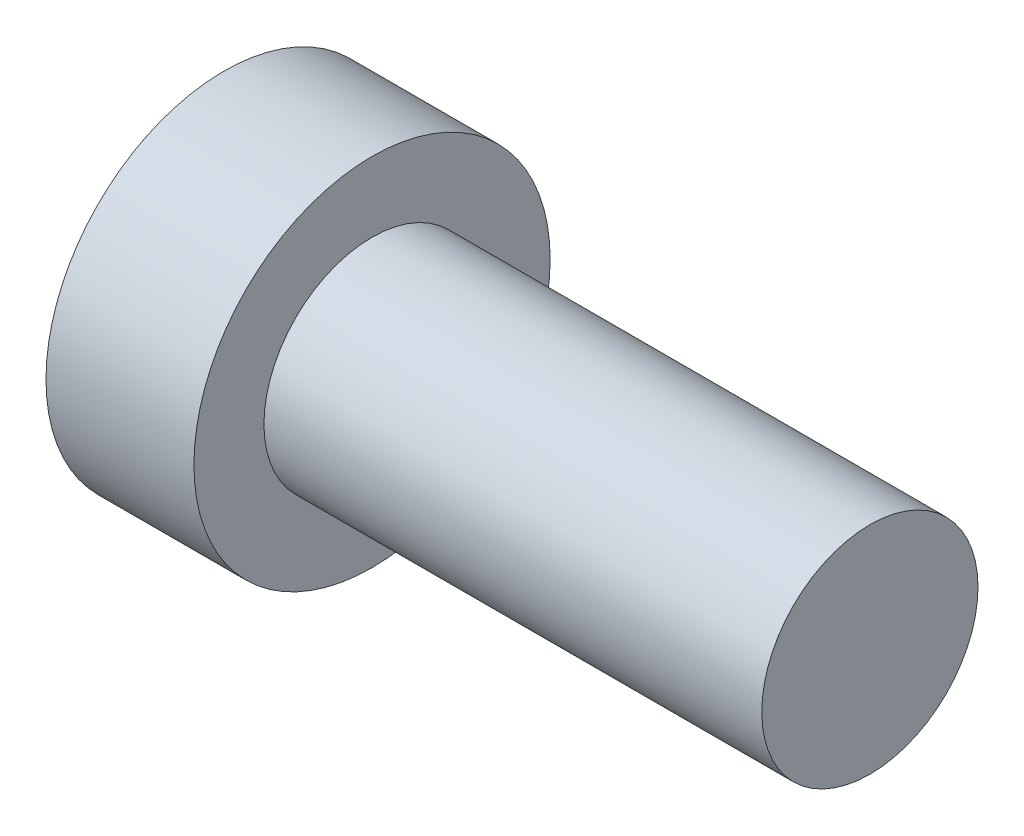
SolidWorks part; units mm, degrees
ref_plane "Plane1" through (0, 0, 0) normal (0, 0, 1) x (1, 0, 0)
ref_plane "Plane2" through (0, 0, 0) normal (0, 1, 0) x (1, 0, 0)
ref_plane "Plane3" through (0, 0, 0) normal (1, 0, 0) x (0, 0, -1)
revolve "Base-Revolve" add sketch "BodySke" angle 360 about L2
sketch "BodySke" plane through (0, 0, 0) normal (0, 0, 1) x (1, 0, 0)
  line L0 (4.572, 2.413) -> (4.572, 3.9751)
  line L1 (4.572, 3.9751) -> (1.27, 3.9751)
  line L2 (-25.4, 0) -> (127, 0) construction
  line L3 (15.6845, 0) -> (0, 0)
  line L4 (4.572, 2.413) -> (15.6845, 2.413)
  line L5 (15.6845, 2.413) -> (15.6845, 0)
  line L6 (4.572, -3.9751) -> (1.27, -3.9751) construction
  line L7 (4.572, -2.413) -> (15.6845, -2.413) construction
  line L8 (5.6312, 1.2192) -> (5.6312, -0.4698) construction
  line L9 (4.572, 1.2192) -> (4.572, -0.4698) construction
  arc A0 (0, 0) -> (1.27, 3.9751) centre (6.856, 0) cw
  dimension "Head_ht" = 4.572
  dimension "Diameter" = 4.826
  dimension "Length" = 11.1125
  dimension "Head_dia" = 7.9502
  dimension "Head_side_ht" = 3.302
  dimension "Advance" = 1.0592
  dimension "Thread_nom" = 11.1125
sketch "Sketch2" plane through (0, 0, 0) normal (1, 0, 0) x (0, 0, -1)
  line L0 (-3.9751, -0.762) -> (-3.9751, 0.762)
  line L1 (-3.9751, 0.762) -> (3.9751, 0.762)
  line L2 (3.9751, 0.762) -> (3.9751, -0.762)
  line L3 (3.9751, -0.762) -> (-3.9751, -0.762)
  dimension "D1" = 7.9502
  dimension "D2" = 3.9751
  dimension "D3" = 0.762
  dimension "Slot_width" = 1.524
extrude "Slot" cut sketch "Sketch2" along normal blind 2.1082
sketch "Sketch3" plane through (0, 0, 0) normal (1, 0, 0) x (0, 0, -1)
  line L0 (0.5461, -2.9845) -> (-0.5461, -2.9845)
  line L1 (0.5461, -2.9845) -> (0.5461, 2.9845)
  line L2 (-0.5461, 2.9845) -> (0.5461, 2.9845)
  line L3 (-0.5461, 2.9845) -> (-0.5461, -2.9845)
  dimension "D1" = 0.5461
  dimension "Cross_width" = 1.0922
  dimension "D2" = 2.9845
  dimension "Cross_dia" = 5.969
ref_plane "Plane4" through (3.4036, 0, 0) normal (1, 0, 0) x (0, 0, -1)
sketch "Sketch4" plane through (3.4036, 0, 0) normal (1, 0, 0) x (0, 0, -1)
  line L0 (0.2731, -0.2731) -> (-0.273, -0.2731)
  line L1 (0.2731, -0.2731) -> (0.2731, 0.2731)
  line L2 (-0.2731, 0.2731) -> (0.2731, 0.2731)
  line L3 (-0.2731, 0.2731) -> (-0.273, -0.2731)
  dimension "D1" = 0.5461
  dimension "D2" = 0.2731
  dimension "D3" = 0.5461
  dimension "D4" = 0.2731
loft "Cross" cut profiles "Sketch3", "Sketch4"
pattern_circular "CirPattern1" count 2 every 90 about axis through (0, 0, 0) along (1, 0, 0) of "Cross"
sketch "Sketch5" plane through (0, 0, 0) normal (0, 1, 0) x (1, 0, 0)
  line L4 (-25.4, 0) -> (127, 0) construction
  line L5 (4.572, -6.312) -> (4.572, 6.3337) construction
  circle A0 centre (3.4798, 0) radius 0.5842
  dimension "Drilled_hole_dia" = 1.1684
  dimension "D1" = 4.572
  dimension "Drilled_hole_loc" = 1.0922
extrude "Hole" cut sketch "Sketch5" against normal through all and the other way through all
sketch "ThdSchSke" plane through (0, 0, 0) normal (0, 0, 1) x (1, 0, 0)
  line L0 (5.6312, -1.7831) -> (5.1901, -2.413)
  line L1 (5.6312, -1.7831) -> (6.0723, -2.413)
  line L2 (6.0723, -2.413) -> (6.0723, -3.0162)
  line L3 (-3.175, 0) -> (5.1513, 0) construction
  line L5 (6.0723, -3.0162) -> (5.1901, -3.0162)
  line L6 (5.1901, -3.0162) -> (5.1901, -2.413)
  dimension "Thread_minor" = 3.5662
  dimension "Diameter" = 4.826
  dimension "Start" = 5.6312
  dimension "SideAngle" = 55
  dimension "VeeAngle" = 70
  dimension "Overcut" = 6.0325
revolve "ThreadSchematic" cut sketch "ThdSchSke" angle 360 about L3
pattern_linear "ThdSchPat"
equation "\"D1@Sketch3\" = \"Cross_width@Sketch3\" / 2"
equation "\"D2@Sketch3\" = \"Cross_dia@Sketch3\" / 2"
equation "\"D1@Sketch4\" = \"Cross_width@Sketch3\"*.5"
equation "\"D2@Sketch4\" = \"D1@Sketch4\" / 2"
equation "\"D3@Sketch4\" = \"D1@Sketch4\""
equation "\"D4@Sketch4\" = \"D2@Sketch4\""
equation "\"D1@Sketch2\" = \"Head_dia@BodySke\""
equation "\"D2@Sketch2\" = \"D1@Sketch2\" / 2"
equation "\"D3@Sketch2\" = \"Slot_width@Sketch2\" / 2"
equation "\"D1@Sketch5\" = \"Head_ht@BodySke\""
equation "\"Thread_length@ThreadCosmetic\" = ((sgn( (\"Length@BodySke\" - \"Advance@BodySke\" ) - \"Thread_nom@BodySke\" )-1)*( (\"Length@BodySke\" - \"Advance@BodySke\" ) - \"Thread_nom@BodySke\" ))/-2+ \"Thread_nom@BodySke\""
equation "\"Thread_minor@ThdSchSke\" = \"Thread_minor@ThreadCosmetic\""
equation "\"Diameter@ThdSchSke\" = \"Diameter@BodySke\""
equation "\"Overcut@ThdSchSke\" = \"Diameter@BodySke\" * 1.25"
equation "\"Start@ThdSchSke\" = \"Head_ht@BodySke\" + \"Length@BodySke\" - \"Thread_length@ThreadCosmetic\"  '---Non-countersunk---"
equation "\"Num_threads@ThdSchPat\" = int( \"Thread_length@ThreadCosmetic\" / \"Advance@BodySke\" + 0.999 )  + 1"
equation "\"Advance@ThdSchPat\" = \"Thread_length@ThreadCosmetic\" /  (\"Num_threads@ThdSchPat\" - 1) 'relax it"
